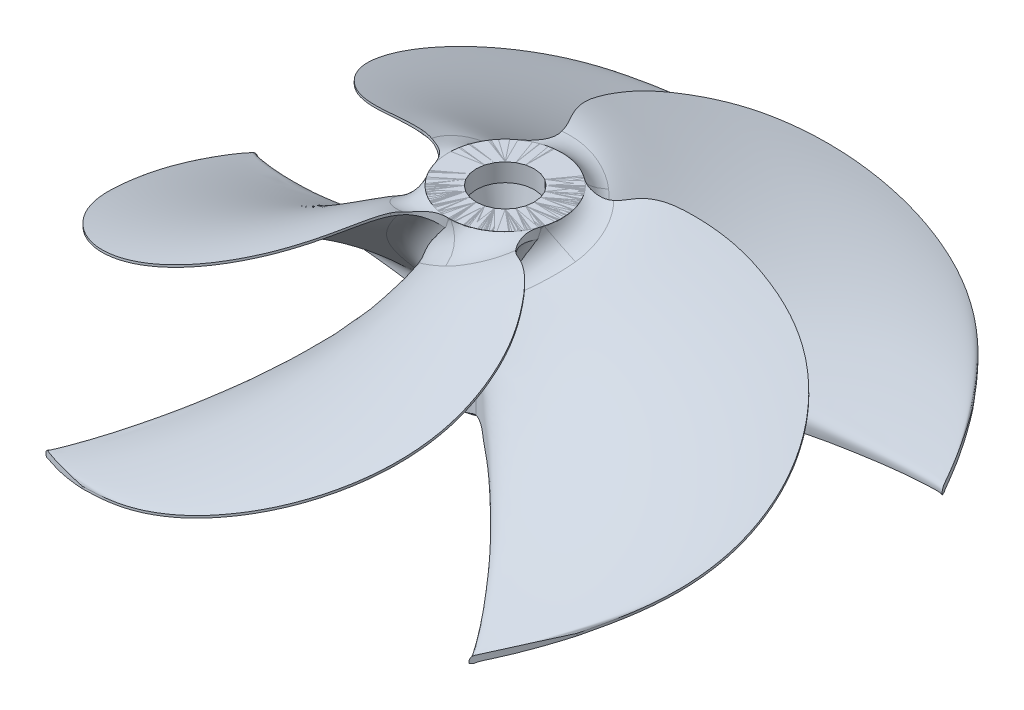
SolidWorks part; units mm, degrees
ref_plane "Plan de face" through (0, 0, 0) normal (0, 0, 1) x (1, 0, 0)
ref_plane "Plan de dessus" through (0, 0, 0) normal (0, 1, 0) x (1, 0, 0)
ref_plane "Plan de droite" through (0, 0, 0) normal (1, 0, 0) x (0, 0, -1)
imported_body "Importée2"
pattern_circular "Répétition circulaire2" count 5 over 360
sketch "Esquisse1" plane through (0, -126.6011, 0) normal (0, -1, 0) x (1, 0, 0)
  circle A0 centre (0, 0) radius 23
  dimension "D1" = 46
extrude "Extrusion1" cut sketch "Esquisse1" against normal blind 241
other "Flexion1" parameters "D0"=20, "D1"=0, "D2"=0
sketch "Esquisse2" plane through (0, 0, 0) normal (0, 0, 1) x (1, 0, 0)
  line L0 (0, 161.7653) -> (0, -213.1731) construction
  line L1 (-35, 83.7405) -> (-35, 61.9405)
  line L2 (-42.2227, 83.7405) -> (-68.5001, 83.7405) construction
  line L3 (-23.0012, 17.1605) -> (-23.0012, -88.9931)
  line L4 (-35, 61.9405) -> (-23.0012, 17.1605)
  line L5 (-23.0012, -88.9931) -> (-43, -88.9931)
  line L6 (-43, -88.9931) -> (-43, -115.9931)
  line L7 (-63.4996, -115.9931) -> (37.3244, -115.9931) construction
  line L8 (0, 83.7405) -> (-23, 83.7405) construction
  line L9 (-23, -115.9931) -> (0, -115.9931) construction
  line L10 (-35, 83.7405) -> (0, 83.7405)
  line L11 (0, 83.7405) -> (0, -115.9931)
  line L12 (0, -115.9931) -> (-43, -115.9931)
  dimension "D1" = 70
  dimension "D2" = 15
  dimension "D3" = 44.78
  dimension "D4" = 21.8
  dimension "D5" = 27
  dimension "D6" = 86
revolve "Enlèvement de matière-Révolution1" cut sketch "Esquisse2" angle 360 about L0
ref_plane "Plan1" through (0, 100, 0) normal (0, 1, 0) x (-1, 0, 0)
